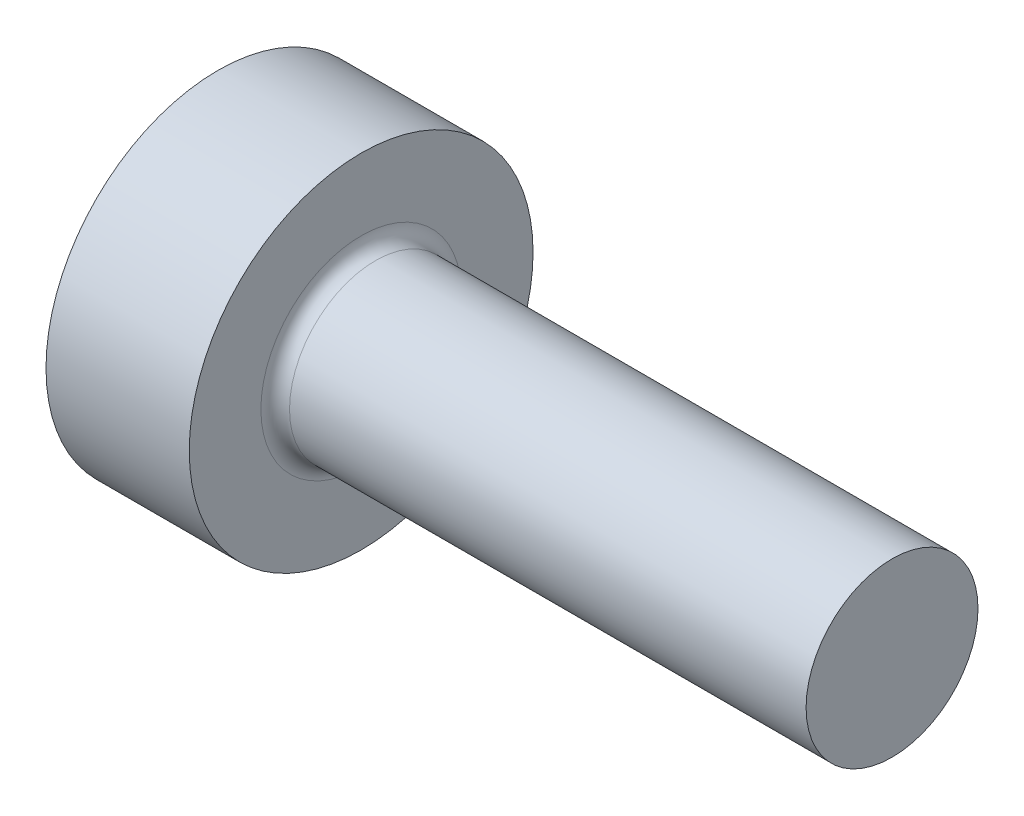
SolidWorks part; units mm, degrees
ref_plane "Face" through (0, 0, 0) normal (0, 0, 1) x (1, 0, 0)
ref_plane "Dessus" through (0, 0, 0) normal (0, 1, 0) x (1, 0, 0)
ref_plane "Droite" through (0, 0, 0) normal (1, 0, 0) x (0, 0, -1)
imported_body "Importée1"
sketch "Esquisse1" plane through (100, 0, 0) normal (1, 0, 0) x (0, 0, -1)
  circle A1 centre (0, 0) radius 3
  circle A2 centre (0, 0) radius 3
  dimension "D1" = 0
extrude "Enlèv. mat.-Extru.1" cut sketch "Esquisse1" against normal blind 76.47
